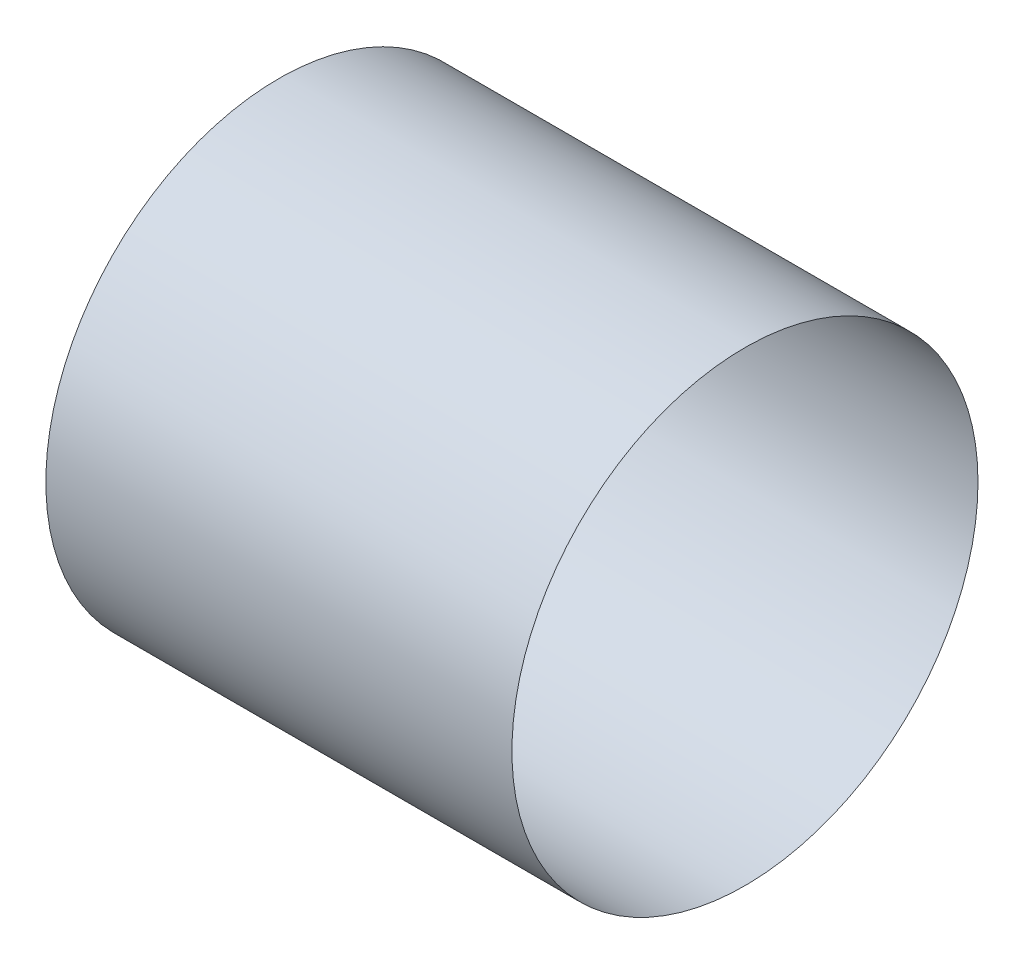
SolidWorks part; units mm, degrees
ref_plane "Front Plane" through (0, 0, 0) normal (0, 0, 1) x (1, 0, 0)
ref_plane "Top Plane" through (0, 0, 0) normal (0, 1, 0) x (1, 0, 0)
ref_plane "Right Plane" through (0, 0, 0) normal (1, 0, 0) x (0, 0, -1)
sketch "Sketch1" plane through (0, 0, 0) normal (1, 0, 0) x (0, 0, -1)
  circle A0 centre (0, 0) radius 10
  dimension "D1" = 20
surface "Surface-Extrude1" sketch "Sketch1" parameters "D1"=20
